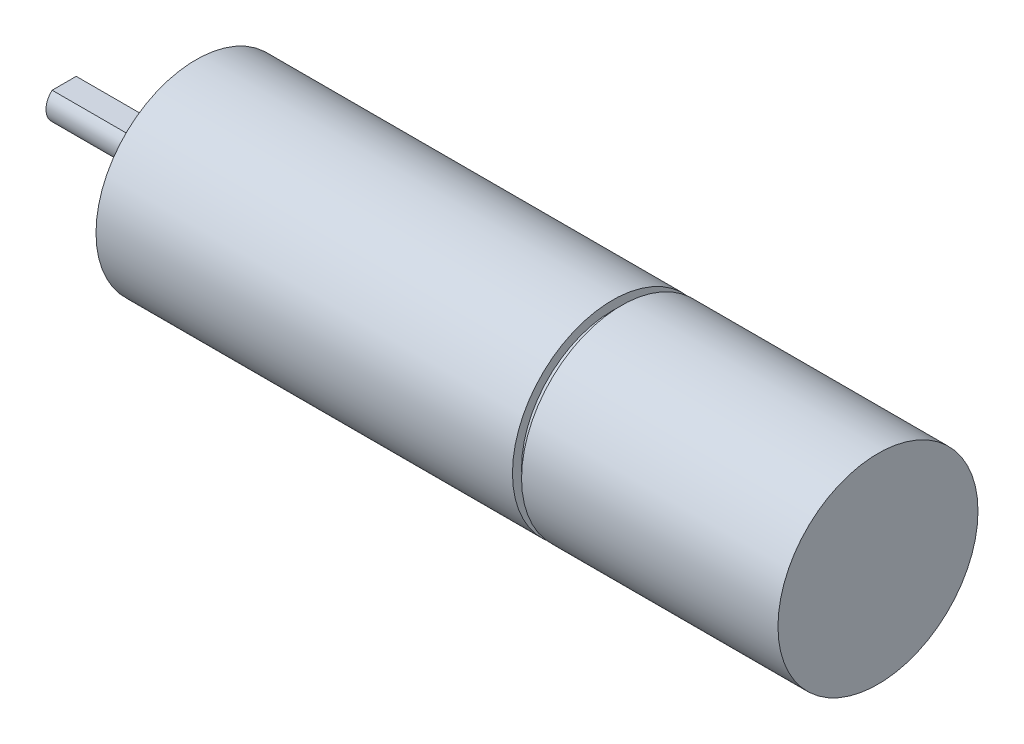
SolidWorks part; units mm, degrees
ref_plane "Front" through (0, 0, 0) normal (0, 0, 1) x (1, 0, 0)
ref_plane "Top" through (0, 0, 0) normal (0, 1, 0) x (1, 0, 0)
ref_plane "Right" through (0, 0, 0) normal (1, 0, 0) x (0, 0, -1)
sketch "Sketch2" plane through (0, 0, 0) normal (0, 1, 0) x (1, 0, 0)
  line L0 (0, 0) -> (-75.7752, 0) construction
  line L1 (-60.3, 0) -> (-60.3, 2)
  line L2 (-60.3, 2) -> (-48.95, 2)
  line L3 (-48.95, 2) -> (-48.95, 3.5)
  line L4 (-48.95, 3.5) -> (-47.1, 3.5)
  line L5 (-47.1, 3.5) -> (-47.1, 5)
  line L6 (-47.1, 5) -> (-45.8, 5)
  line L7 (-45.8, 5) -> (-45.8, 11)
  line L8 (-45.8, 11) -> (0, 11)
  line L9 (0, 11) -> (0, 10)
  line L10 (0, 10) -> (1, 10)
  line L11 (1, 10) -> (1, 11)
  line L12 (1, 11) -> (29.2, 11)
  line L13 (29.2, 11) -> (29.2, 0)
  line L14 (29.2, 0) -> (-60.3, 0)
  dimension "D1" = 75
  dimension "D2" = 45.8
  dimension "D3" = 22
  dimension "D4" = 4
  dimension "D5" = 14.5
  dimension "D6" = 1.3
  dimension "D7" = 3.15
  dimension "D8" = 10
  dimension "D9" = 7
  dimension "D10" = 20
  dimension "D11" = 1
revolve "Revolve1" add sketch "Sketch2" angle 360 about L0
sketch "Sketch3" plane through (-60.3, 0, 0) normal (-1, 0, 0) x (0, 0, 1)
  line L1 (-4.4888, 4.9336) -> (6.0639, 4.9336)
  line L2 (-4.4888, 4.9336) -> (-4.4888, 1.5)
  line L3 (-4.4888, 1.5) -> (6.0639, 1.5)
  line L4 (6.0639, 4.9336) -> (6.0639, 1.5)
  dimension "D1" = 1.5
extrude "Cut-Extrude1" cut sketch "Sketch3" against normal up to surface (11.35 mm away)
hole_wizard "M2.5x0.45 Tapped Hole1" positions "Sketch5" profile "Sketch4" tap size "M2.5x0.45" standard "Ansi Metric"
sketch "Sketch5" plane through (-45.8, 0, 0) normal (-1, 0, 0) x (0, 0, 1)
  line L0 (0, 0) -> (0, 7) construction
  line L4 (0, 0) -> (6.0622, -3.5) construction
  circle A0 centre (0, 0) radius 7 construction
  point P0 (0, 7)
  point P15 (6.0622, -3.5)
  point P24 (-6.0622, -3.5)
  dimension "D1" = 14
  dimension "D2" = 120
sketch "Sketch4" plane through (-45.8, 7, 0) normal (0, 1, 0) x (0, 0, 1)
  line L0 (0, 0) -> (0, 6.9659)
  line L1 (0, 6.9659) -> (1.025, 6.35)
  line L2 (1.025, 6.35) -> (1.025, 0)
  line L5 (1.025, 0) -> (0, 0)
  line L10 (0, 6.9659) -> (-1.025, 6.35) construction
  line L11 (0, -6.35) -> (0, 107.95) construction
  dimension "Tap Drill Dia." = 2.05
  dimension "Tap Drill Depth" = 6.35
  dimension "Drill Angle" = 118
